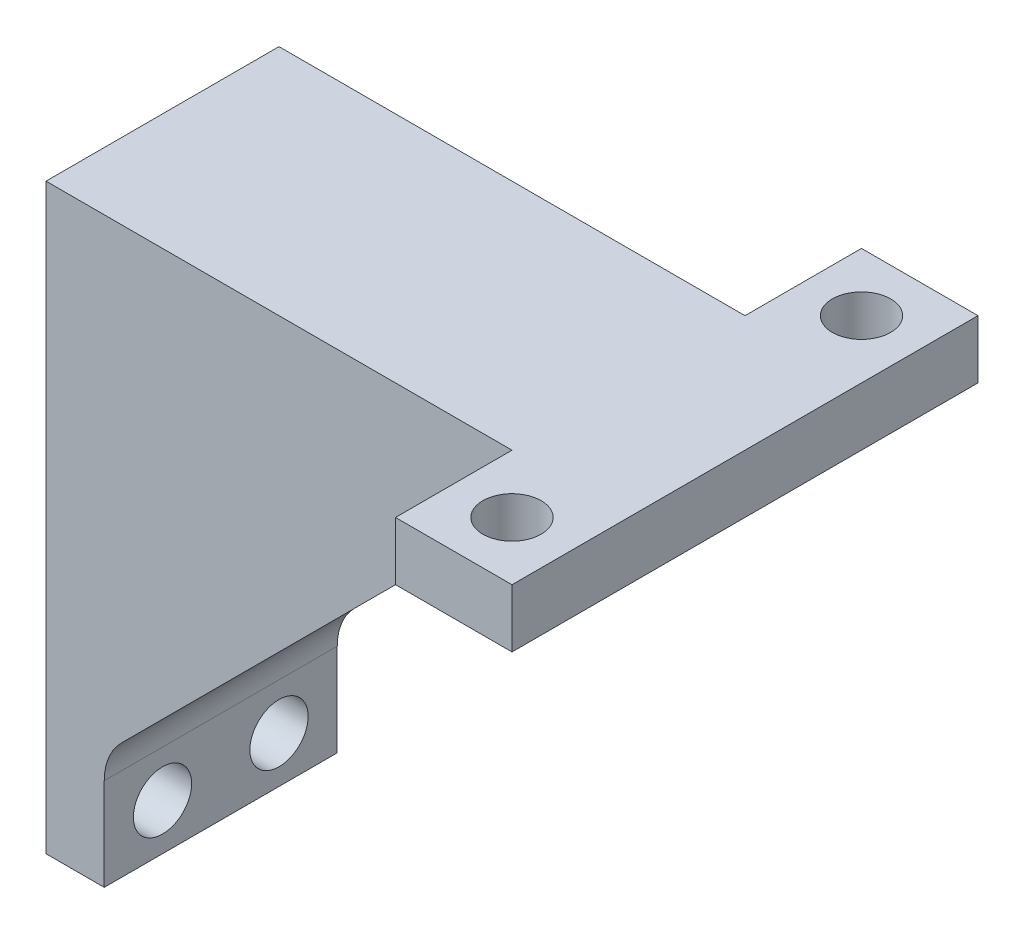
SolidWorks part; units mm, degrees
ref_plane "Front Plane" through (0, 0, 0) normal (0, 0, 1) x (1, 0, 0)
ref_plane "Top Plane" through (0, 0, 0) normal (0, 1, 0) x (1, 0, 0)
ref_plane "Right Plane" through (0, 0, 0) normal (1, 0, 0) x (0, 0, -1)
sketch "Sketch1" plane through (0, 0, 0) normal (0, 0, 1) x (1, 0, 0)
  line L0 (0, 0) -> (0, 70)
  line L1 (0, 70) -> (70, 70)
  line L2 (70, 70) -> (0, 0)
  dimension "D1" = 70
  dimension "D2" = 70
extrude "Boss-Extrude1" add sketch "Sketch1" along normal blind 40
sketch "Sketch2" plane through (0, 70, 0) normal (0, 1, 0) x (1, 0, 0)
  line L0 (70, -40) -> (70, -60)
  line L1 (0, 0) -> (70, 0)
  line L2 (0, 0) -> (0, -40)
  line L3 (0, -40) -> (70, -40)
  line L5 (90, 20) -> (70, 20)
  line L6 (90, 20) -> (90, -60)
  line L7 (90, -60) -> (70, -60)
  line L8 (70, 20) -> (70, 0)
  dimension "D3" = 20
  dimension "D4" = 80
  dimension "D5" = 20
  dimension "D6" = 40
  dimension "D7" = 70
extrude "Boss-Extrude2" add sketch "Sketch2" along normal blind 10
sketch "Sketch3" plane through (0, 0, 0) normal (-1, 0, 0) x (0, 0, 1)
  line L1 (0, 80) -> (40, 80)
  line L2 (0, 80) -> (0, -20)
  line L3 (0, -20) -> (40, -20)
  line L4 (40, 80) -> (40, -20)
  dimension "D1" = 40
  dimension "D2" = 100
extrude "Boss-Extrude3" add sketch "Sketch3" along normal blind 10
fillet "Fillet1" radius 10 2 edges at (70, 70, 20) (0, 0, 20)
sketch "Sketch4" plane through (0, 70, 0) normal (0, -1, 0) x (1, 0, 0)
  line L0 (80, 60) -> (80, -20) construction
  line L4 (90, -20) -> (70, -20) construction
  line L5 (70, 60) -> (90, 60) construction
  circle A0 centre (80, -10) radius 5
  circle A1 centre (80, 50) radius 5
  dimension "D1" = 10
  dimension "D2" = 10
  dimension "D3" = 10
  dimension "D4" = 10
extrude "Cut-Extrude1" cut sketch "Sketch4" against normal blind 10
sketch "Sketch5" plane through (0, 0, 0) normal (1, 0, 0) x (0, 1, 0)
  line L0 (-12.0711, 40) -> (-12.0711, 0) construction
  line L3 (-20, 40) -> (-4.1421, 40) construction
  line L4 (-4.1421, 0) -> (-20, 0) construction
  circle A0 centre (-12.0711, 10) radius 5
  circle A1 centre (-12.0711, 30) radius 5
  dimension "D1" = 10
  dimension "D2" = 10
  dimension "D3" = 20
  dimension "D4" = 10
extrude "Cut-Extrude2" cut sketch "Sketch5" against normal blind 10
